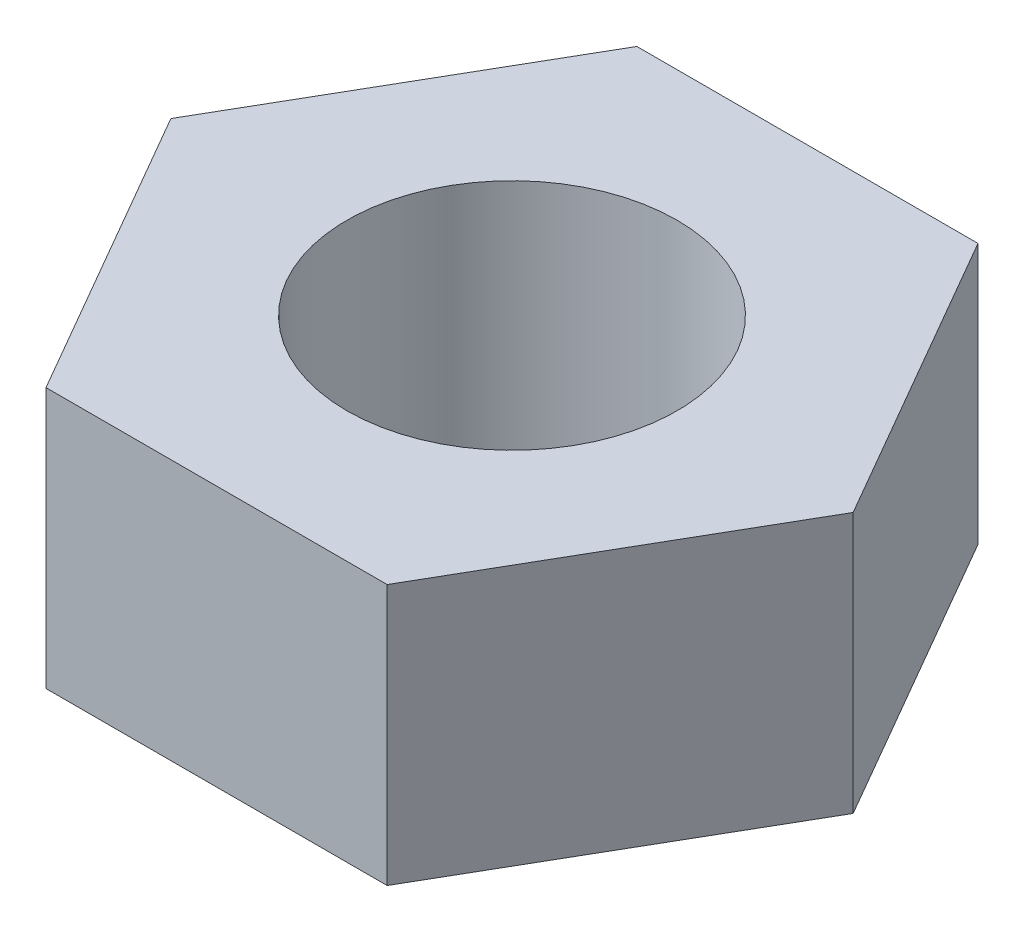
SolidWorks part; units mm, degrees
ref_plane "Alzado" through (0, 0, 0) normal (0, 0, 1) x (1, 0, 0)
ref_plane "Planta" through (0, 0, 0) normal (0, 1, 0) x (1, 0, 0)
ref_plane "Vista lateral" through (0, 0, 0) normal (1, 0, 0) x (0, 0, -1)
sketch "Sketch1" plane through (0, 0, 0) normal (0, 1, 0) x (1, 0, 0)
  line L0 (0, 0) -> (3.926, 0) construction
  line L1 (3.926, 0) -> (1.963, 3.4)
  line L2 (1.963, 3.4) -> (-1.963, 3.4)
  line L3 (-1.963, 3.4) -> (-3.926, 0)
  line L4 (-3.926, 0) -> (-1.963, -3.4)
  line L5 (-1.963, -3.4) -> (1.963, -3.4)
  line L6 (1.963, -3.4) -> (3.926, 0)
  circle A0 centre (0, 0) radius 3.4 construction
  circle A1 centre (0, 0) radius 1.9
  dimension "D1" = 6.8
  dimension "D2" = 3.8
extrude "Boss-Extrude1" add sketch "Sketch1" along normal blind 3
